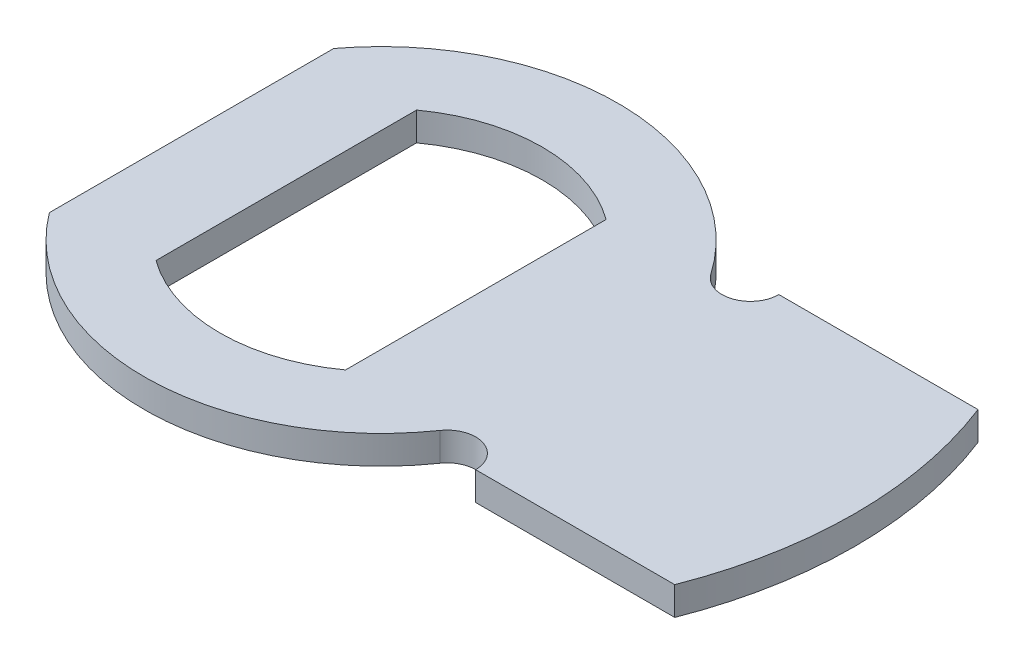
SolidWorks part; units mm, degrees
ref_plane "Front Plane" through (0, 0, 0) normal (0, 0, 1) x (1, 0, 0)
ref_plane "Top Plane" through (0, 0, 0) normal (0, 1, 0) x (1, 0, 0)
ref_plane "Right Plane" through (0, 0, 0) normal (1, 0, 0) x (0, 0, -1)
sketch "Sketch1" plane through (0, 0, 0) normal (0, 1, 0) x (1, 0, 0)
  line L0 (-44.5069, 0) -> (91.7277, 0) construction
  line L1 (0, 25) -> (0, -25) construction
  line L2 (10, 25) -> (10, -25) construction
  line L3 (10, 13.7477) -> (10, -13.7477)
  line L4 (-20, 15) -> (-20, -15)
  line L5 (25.9783, 16) -> (22.9783, 16) construction
  line L6 (25.9783, -16) -> (22.9783, -16) construction
  line L7 (25.9783, 16) -> (46.9878, 16)
  line L8 (-10, 13.7477) -> (-10, -13.7477)
  line L9 (25.9783, -16) -> (46.9878, -16)
  arc A0 (-10, -13.7477) -> (10, -13.7477) centre (0, 0) ccw
  arc A1 (-20, -15) -> (20.5163, -14.2857) centre (0, 0) ccw
  arc A2 (46.9878, -16) -> (46.9878, 16) centre (6, 0) ccw
  arc A3 (10, 13.7477) -> (-10, 13.7477) centre (0, 0) ccw
  arc A4 (20.5163, 14.2857) -> (25.9783, 16) centre (22.9783, 16) ccw
  arc A5 (25.9783, -16) -> (20.5163, -14.2857) centre (22.9783, -16) ccw
  arc A6 (20.5163, 14.2857) -> (-20, 15) centre (0, 0) ccw
  dimension "D3" = 34
  dimension "D4" = 50
  dimension "D5" = 88
  dimension "D10" = 6
  dimension "D11" = 6
  dimension "D1" = 6
  dimension "D2" = 16
  dimension "D6" = 16
  dimension "D7" = 10
  dimension "D9" = 10
  dimension "D8" = 10
extrude "Extrude1" add sketch "Sketch1" along normal blind 3
